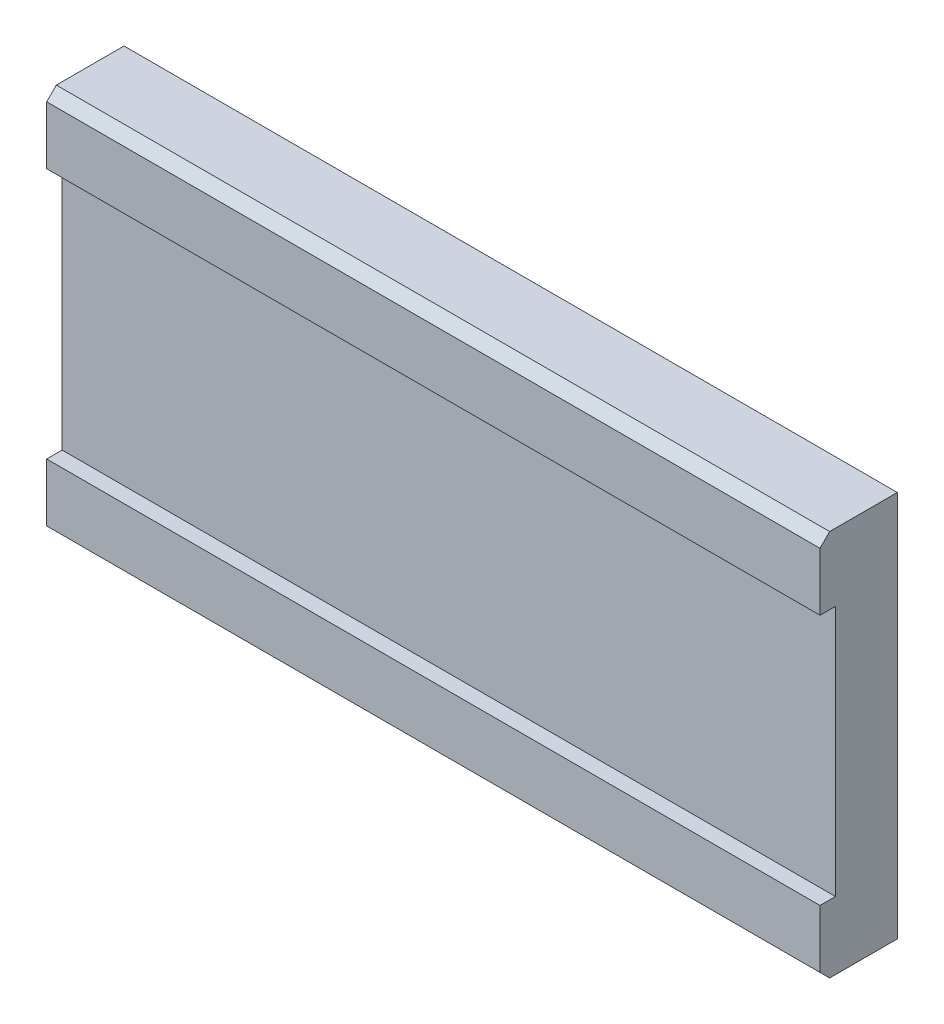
SolidWorks part; units mm, degrees
ref_plane "Ebene vorne" through (0, 0, 0) normal (0, 0, 1) x (1, 0, 0)
ref_plane "Ebene oben" through (0, 0, 0) normal (0, 1, 0) x (1, 0, 0)
ref_plane "Ebene rechts" through (0, 0, 0) normal (1, 0, 0) x (0, 0, -1)
sketch "Skizze1" plane through (0, 0, 0) normal (0, 0, 1) x (1, 0, 0)
  line L1 (0, 0) -> (200, 0)
  line L2 (0, 0) -> (0, 100)
  line L3 (0, 100) -> (200, 100)
  line L4 (200, 0) -> (200, 100)
  dimension "D1" = 200
  dimension "D2" = 100
extrude "Linear austragen1" add sketch "Skizze1" along normal blind 20
sketch "Skizze2" plane through (0, 0, 20) normal (0, 0, 1) x (1, 0, 0)
  line L0 (0, 100) -> (0, 0) construction
  line L1 (0, 82.5) -> (200, 82.5)
  line L2 (0, 82.5) -> (0, 17.5)
  line L3 (0, 17.5) -> (200, 17.5)
  line L4 (200, 82.5) -> (200, 17.5)
  line L5 (200, 0) -> (200, 100) construction
  line L6 (200, 100) -> (0, 100) construction
  dimension "D1" = 65
  dimension "D2" = 17.5
extrude "Linear austragen2" cut sketch "Skizze2" against normal blind 4
chamfer "Fase1" distance 2.5 2 edges at (100, 100, 20) (100, 0, 20)
